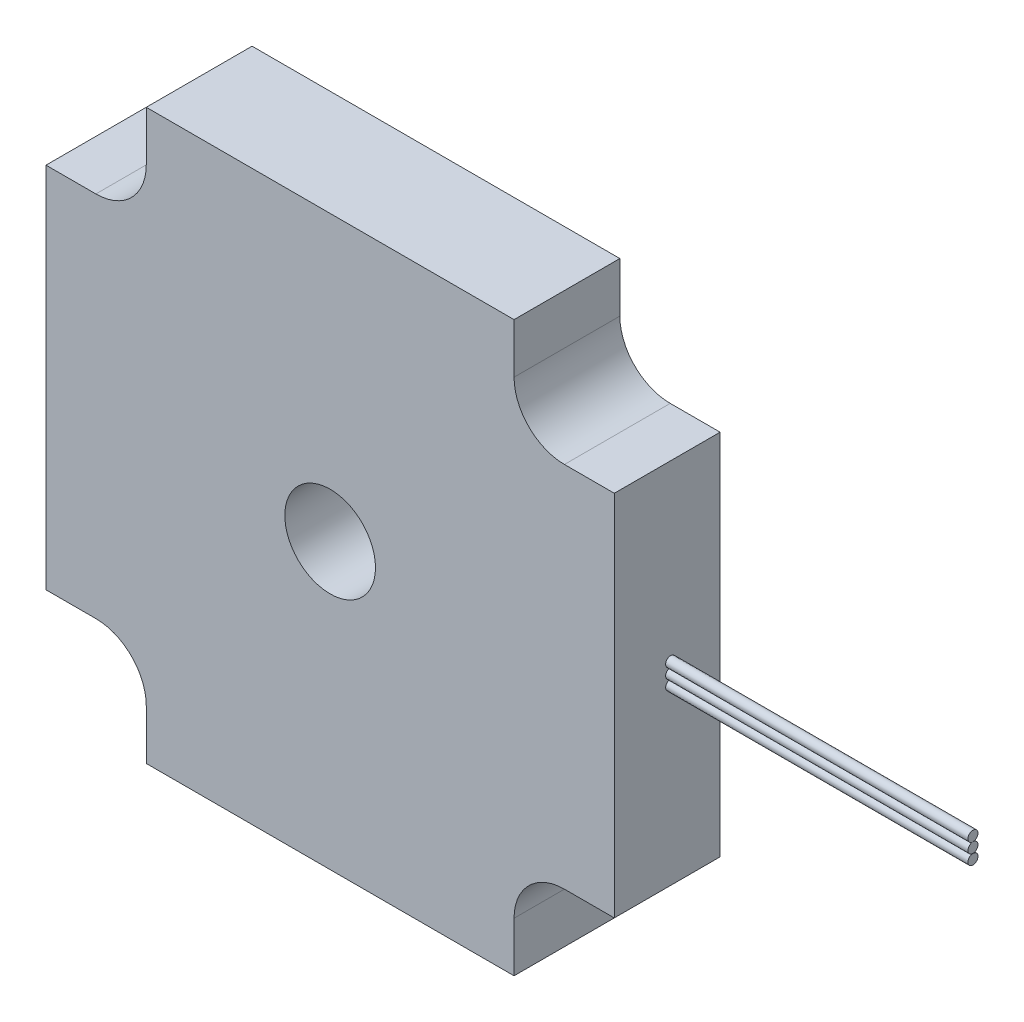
SolidWorks part; units mm, degrees
ref_plane "前视" through (0, 0, 0) normal (0, 0, 1) x (1, 0, 0)
ref_plane "上视" through (0, 0, 0) normal (0, 1, 0) x (1, 0, 0)
ref_plane "右视" through (0, 0, 0) normal (1, 0, 0) x (0, 0, -1)
sketch "草图2" plane through (0, 0, 0) normal (0, 0, 1) x (1, 0, 0)
  line L0 (-18.25, 18.25) -> (-28.2, 18.25)
  line L1 (18.25, -28.2) -> (-18.25, -28.2)
  line L2 (28.2, -18.25) -> (28.2, 18.25)
  line L3 (18.25, 28.2) -> (-18.25, 28.2)
  line L4 (-28.2, -18.25) -> (-28.2, 18.25)
  line L5 (28.2, -28.2) -> (-28.2, 28.2) construction
  line L6 (28.2, 28.2) -> (-28.2, -28.2) construction
  line L7 (28.2, -18.25) -> (18.25, -18.25)
  line L9 (28.2, 18.25) -> (18.25, 18.25)
  line L11 (28.2, -18.25) -> (-28.2, 18.25) construction
  line L12 (28.2, 18.25) -> (-28.2, -18.25) construction
  line L14 (18.25, -28.2) -> (18.25, -18.25)
  line L16 (-18.25, -28.2) -> (-18.25, -18.25)
  line L17 (18.25, -28.2) -> (-18.25, 28.2) construction
  line L18 (18.25, 28.2) -> (-18.25, -28.2) construction
  line L19 (18.25, 18.25) -> (18.25, 28.2)
  line L20 (-18.25, -18.25) -> (-28.2, -18.25)
  line L21 (-18.25, 18.25) -> (-18.25, 28.2)
  point P0 (0, 0)
  point P6 (0, 0)
  point P11 (0, 0)
  dimension "D1" = 56.4
  dimension "D2" = 56.4
  dimension "D3" = 36.5
  dimension "D4" = 36.5
extrude "凸台-拉伸1" add sketch "草图2" along normal blind 10.5
sketch "草图3" plane through (0, 0, 10.5) normal (0, 0, 1) x (1, 0, 0)
  circle A0 centre (0, 0) radius 4.5
extrude "切除-拉伸1" cut sketch "草图3" against normal blind 10.5
fillet "圆角1" radius 5 4 edges at (18.25, -18.25, 5.25) (-18.25, -18.25, 5.25) (-18.25, 18.25, 5.25) (18.25, 18.25, 5.25)
sketch "草图4" plane through (28.2, 0, 0) normal (1, 0, 0) x (0, 0, -1)
  circle A0 centre (-4.9064, 0) radius 0.5
  circle A1 centre (-4.9064, 1) radius 0.5
  circle A2 centre (-4.9064, -1) radius 0.5
extrude "凸台-拉伸2" add sketch "草图4" along normal blind 30 separate body
